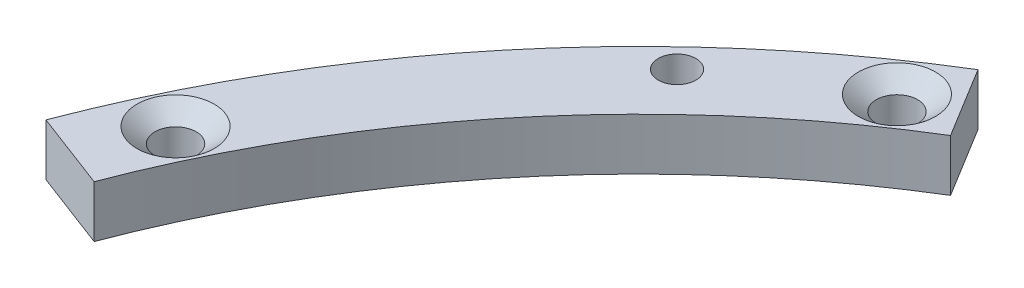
SolidWorks part; units mm, degrees
ref_plane "Front Plane" through (0, 0, 0) normal (0, 0, 1) x (1, 0, 0)
ref_plane "Top Plane" through (0, 0, 0) normal (0, 1, 0) x (1, 0, 0)
ref_plane "Right Plane" through (0, 0, 0) normal (1, 0, 0) x (0, 0, -1)
sketch "Sketch1" plane through (0, 0, 0) normal (0, 1, 0) x (1, 0, 0)
  line L0 (-80.7335, 30.6619) -> (-87.857, 33.3674)
  line L1 (-45.0739, 73.6641) -> (-49.051, 80.1638)
  line L2 (-45.0739, 73.6641) -> (0, 0) construction
  line L3 (0, 0) -> (-80.7335, 30.6619) construction
  line L4 (-62.8989, 66.3702) -> (0, 0) construction
  arc A0 (-45.0739, 73.6641) -> (-80.7335, 30.6619) centre (0, 0) ccw
  arc A1 (-49.051, 80.1638) -> (-87.857, 33.3674) centre (0, 0) ccw
  arc A2 (-47.7253, 77.9973) -> (-85.4825, 32.4656) centre (0, 0) ccw construction
  circle A3 centre (-62.8989, 66.3702) radius 1.7272
  circle A4 centre (-53.0265, 74.4947) radius 2.1527 construction
  circle A5 centre (-83.0216, 38.3235) radius 2.1527 construction
  dimension "D1" = 187.96
  dimension "D2" = 7.62
  dimension "D3" = 182.88
  dimension "D4" = 3.4544
  dimension "D9" = 4.3053
  dimension "D5" = 6.35
  dimension "D6" = 46.99
  dimension "D7" = 12
  dimension "D8" = 6.35
extrude "Extrude1" add sketch "Sketch1" along normal blind 4.7625
hole_wizard "CSK for #6 Flat Head Machine Screw (100)1" positions "Sketch3" profile "Sketch4" countersink size "#6" standard "Ansi Inch"
sketch "Sketch3" plane through (0, 4.7625, 0) normal (0, 1, 0) x (-1, 0, 0)
  line L1 (45.0739, -73.6641) -> (49.051, -80.1638) construction
  line L2 (87.857, -33.3674) -> (80.7335, -30.6619) construction
  circle A0 centre (62.8989, -66.3702) radius 1.7272 construction
  arc A2 (47.0624, -76.914) -> (84.2953, -32.0147) centre (0, 0) ccw construction
  point P0 (50.8177, -74.4862)
  point P1 (81.3932, -38.8043)
  dimension "D1" = 14.5542
  dimension "D2" = 46.99
sketch "Sketch4" plane through (-50.8177, 4.7625, -74.4862) normal (1, 0, 0) x (0, 0, 1)
  line L0 (0, 0) -> (0, 4.7625)
  line L1 (0, 4.7625) -> (1.8986, 4.7625)
  line L2 (1.8986, 4.7625) -> (1.8986, 1.38)
  line L3 (1.8986, 1.38) -> (3.5433, 0)
  line L5 (3.5433, 0) -> (0, 0)
  line L6 (-1.8986, 1.38) -> (-3.5433, 0) construction
  line L11 (0, -6.35) -> (0, 107.95) construction
  dimension "Thru Hole Dia." = 3.7973
  dimension "Thru Hole Depth" = 4.7625
  dimension "Near C'Sink Dia." = 7.0866
  dimension "Near C'Sink Angle" = 100
